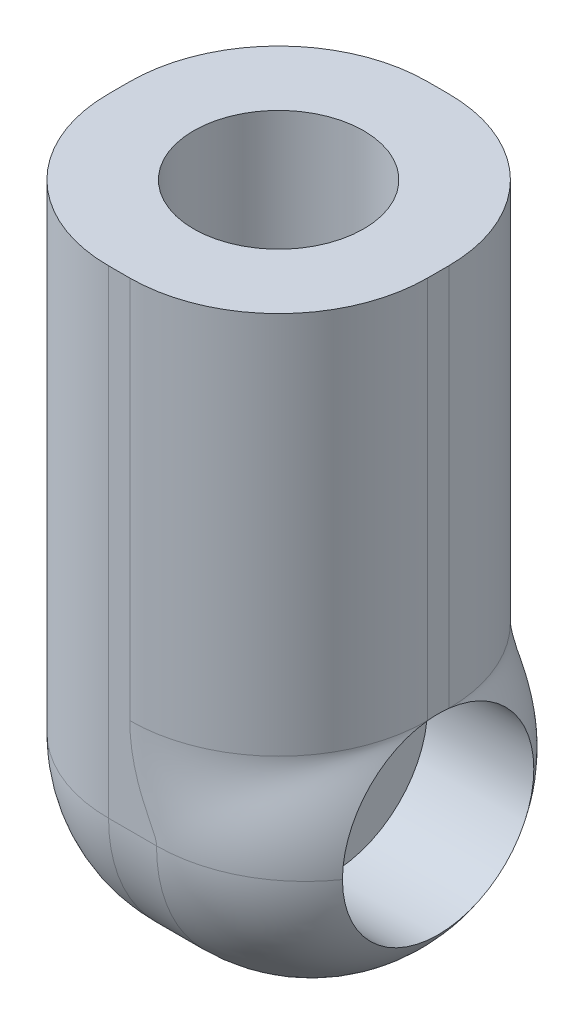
SolidWorks part; units mm, degrees
ref_plane "Plan de face" through (0, 0, 0) normal (0, 0, 1) x (1, 0, 0)
ref_plane "Plan de dessus" through (0, 0, 0) normal (0, 1, 0) x (1, 0, 0)
ref_plane "Plan de droite" through (0, 0, 0) normal (1, 0, 0) x (0, 0, -1)
sketch "Esquisse1" plane through (0, 0, 0) normal (1, 0, 0) x (0, 0, -1)
  line L1 (0, 0) -> (150, 0)
  line L2 (0, 0) -> (0, 300)
  line L3 (0, 300) -> (150, 300)
  line L4 (150, 0) -> (150, 300)
  dimension "D1" = 300
  dimension "D2" = 150
extrude "Boss.-Extru.1" add sketch "Esquisse1" along normal blind 150
sketch "Esquisse3" plane through (150, 0, 0) normal (1, 0, 0) x (0, 0, -1)
  line L0 (0, 0) -> (0, 75) construction
  line L1 (0, 300) -> (0, 0) construction
  line L2 (0, 75) -> (150, 75) construction
  line L3 (150, 0) -> (150, 300) construction
  circle A0 centre (75, 75) radius 45
  dimension "D1" = 75
extrude "Enlèv. mat.-Extru.1" cut sketch "Esquisse3" against normal blind 50
sketch "Esquisse4" plane through (0, 300, 0) normal (0, 1, 0) x (1, 0, 0)
  line L0 (75, 150) -> (75, 0) construction
  line L1 (150, 150) -> (0, 150) construction
  line L2 (150, 0) -> (0, 0) construction
  circle A0 centre (75, 75) radius 40
extrude "Enlèv. mat.-Extru.2" cut sketch "Esquisse4" against normal blind 160
sketch "Esquisse5" plane through (150, 0, 0) normal (1, 0, 0) x (0, 0, -1)
  line L0 (0, 0) -> (150, 0) construction
  line L1 (181.066, 75) -> (150, 75)
  line L2 (-31.066, 75) -> (0, 75)
  arc A0 (150, 0) -> (-31.066, 75) centre (75, 75) cw
  arc A1 (150, 0) -> (181.066, 75) centre (75, 75) ccw
  circle A2 centre (75, 75) radius 75
extrude "Enlèv. mat.-Extru.3" cut sketch "Esquisse5" against normal through all contours A0 L2 M3 | A2 M3 M4 | A0 M4 | A2 M4 M5 | A1 L1 M5
fillet "Congé2" radius 70 5 edges at (0, 187.5, 0) (0, 0, -75) (150, 187.5, 0) (0, 187.5, -150) (150, 187.5, -150)
